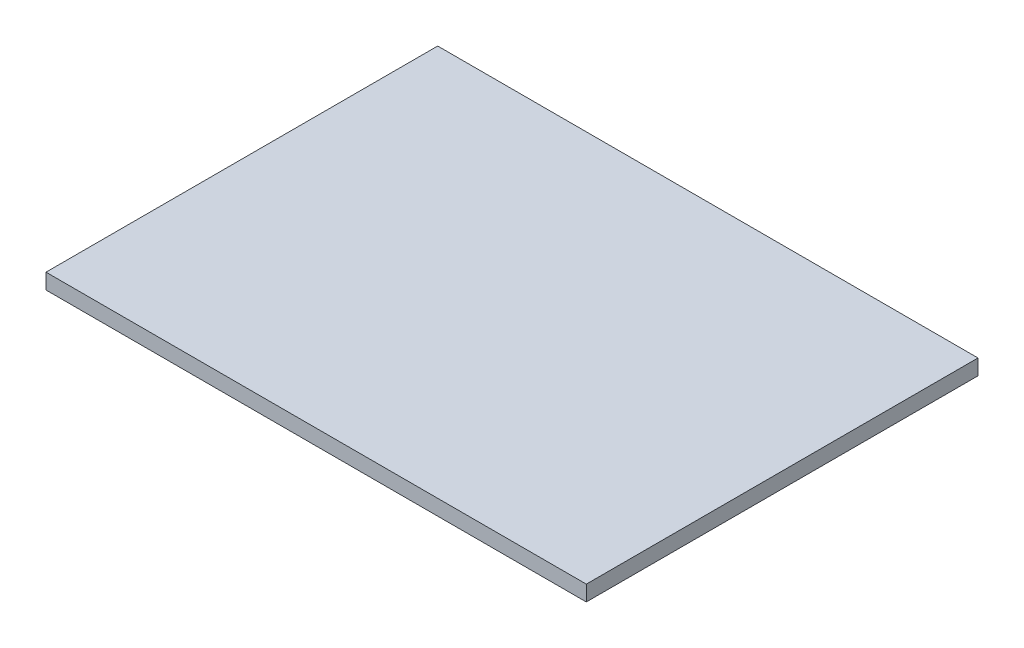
SolidWorks part; units mm, degrees
ref_plane "Alzado" through (0, 0, 0) normal (0, 0, 1) x (1, 0, 0)
ref_plane "Planta" through (0, 0, 0) normal (0, 1, 0) x (1, 0, 0)
ref_plane "Vista lateral" through (0, 0, 0) normal (1, 0, 0) x (0, 0, -1)
sketch "Croquis1" plane through (0, 0, 0) normal (0, 0, 1) x (1, 0, 0)
  line L0 (349, 10) -> (-349, -10) construction
  line L1 (-349, 10) -> (349, 10)
  line L2 (-349, 10) -> (-349, -10)
  line L3 (-349, -10) -> (349, -10)
  line L4 (349, 10) -> (349, -10)
extrude "Extruir1" add sketch "Croquis1" along normal mid plane 506
sketch "Croquis2" plane through (0, -10, 0) normal (0, -1, 0) x (1, 0, 0)
  circle A1 centre (-250, 231.1) radius 17.5
  circle A2 centre (-250, 231.1) radius 17.5
  dimension "D1" = 0
extrude "Cortar-Extruir1" cut sketch "Croquis2" against normal blind 12
mirror "Simetría1" about plane through (0, 0, 0) normal (1, 0, 0) of "Cortar-Extruir1"
